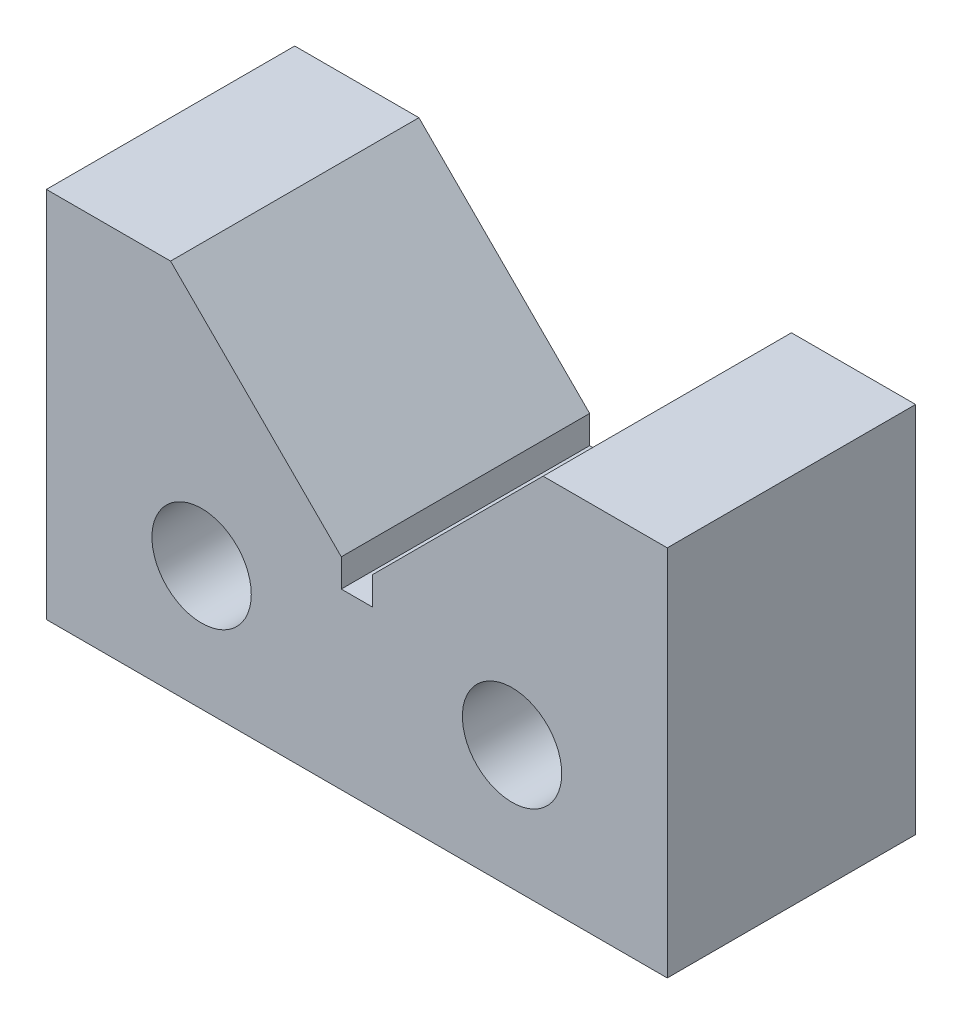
SolidWorks part; units mm, degrees
ref_plane "正面" through (0, 0, 0) normal (0, 0, 1) x (1, 0, 0)
ref_plane "平面" through (0, 0, 0) normal (0, 1, 0) x (1, 0, 0)
ref_plane "右側面" through (0, 0, 0) normal (1, 0, 0) x (0, 0, -1)
sketch "ｽｹｯﾁ1" plane through (0, 0, 0) normal (0, 0, 1) x (1, 0, 0)
  line L1 (-50, 60) -> (50, 60)
  line L2 (-50, 60) -> (-50, 0)
  line L3 (-50, 0) -> (50, 0)
  line L4 (50, 60) -> (50, 0)
  dimension "D1" = 100
  dimension "D2" = 60
extrude "押し出し1" add sketch "ｽｹｯﾁ1" along normal blind 40
sketch "ｽｹｯﾁ3" plane through (0, 0, 40) normal (0, 0, 1) x (1, 0, 0)
  line L0 (0, 60) -> (0, 30) construction
  line L1 (50, 60) -> (-50, 60) construction
  line L2 (30, 60) -> (-30, 60)
  line L3 (-30, 60) -> (0, 30)
  line L4 (30, 60) -> (0, 30)
  dimension "D1" = 60
  dimension "D2" = 90
extrude "ｶｯﾄ - 押し出し1" cut sketch "ｽｹｯﾁ3" against normal through all
sketch "ｽｹｯﾁ4" plane through (0, 0, 40) normal (0, 0, 1) x (1, 0, 0)
  line L0 (-2.5, 32.5) -> (2.5, 32.5)
  line L1 (-30, 60) -> (0, 30) construction
  line L2 (0, 30) -> (30, 60) construction
  line L3 (2.5, 32.5) -> (2.5, 28)
  line L4 (2.5, 28) -> (-2.5, 28)
  line L5 (-2.5, 28) -> (-2.5, 32.5)
  line L6 (-50, 0) -> (50, 0) construction
  dimension "D1" = 5
  dimension "D2" = 28
extrude "ｶｯﾄ - 押し出し2" cut sketch "ｽｹｯﾁ4" against normal through all
sketch "ｽｹｯﾁ5" plane through (0, 0, 40) normal (0, 0, 1) x (1, 0, 0)
  line L0 (-25, 20) -> (25, 20) construction
  line L1 (0, 0) -> (0, 20) construction
  line L2 (-50, 0) -> (50, 0) construction
  circle A0 centre (-25, 20) radius 8
  circle A1 centre (25, 20) radius 8
  dimension "D1" = 16
  dimension "D2" = 50
  dimension "D3" = 20
extrude "ｶｯﾄ - 押し出し3" cut sketch "ｽｹｯﾁ5" against normal through all
